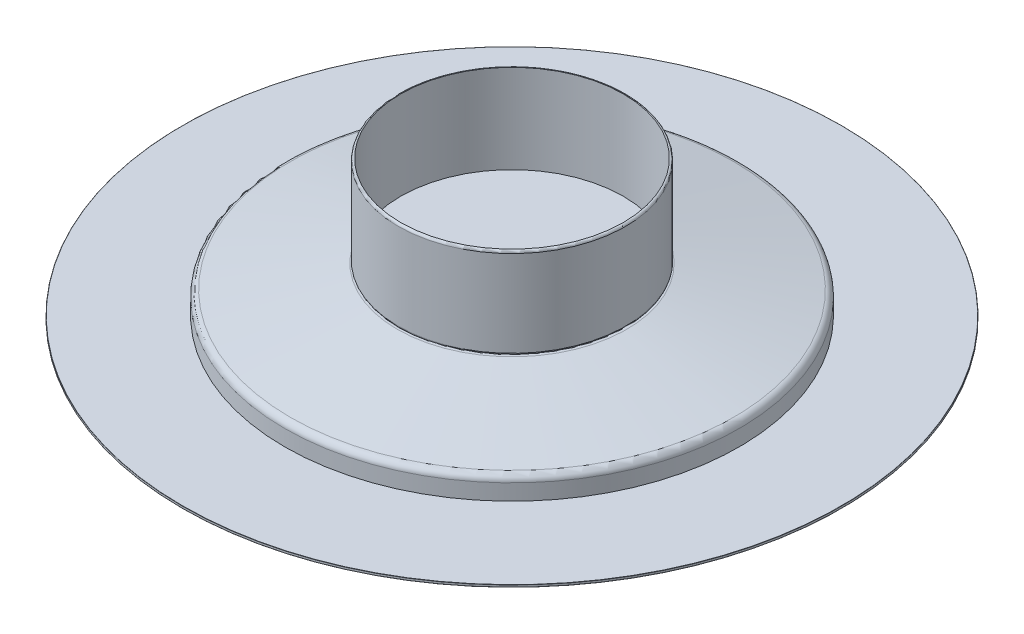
SolidWorks part; units mm, degrees
ref_plane "Alzado" through (0, 0, 0) normal (0, 0, 1) x (1, 0, 0)
ref_plane "Planta" through (0, 0, 0) normal (0, 1, 0) x (1, 0, 0)
ref_plane "Vista lateral" through (0, 0, 0) normal (1, 0, 0) x (0, 0, -1)
sketch "Croquis1" plane through (0, 0, 0) normal (0, 1, 0) x (1, 0, 0)
  circle A0 centre (0, 0) radius 145
  dimension "D1" = 290
extrude "Saliente-Extruir1" add sketch "Croquis1" along normal blind 1
fillet "Redondeo1" radius 0.1 2 edges at (0, 0, 145) (0, 1, 145)
ref_plane "Plano1" through (0, 1, 0) normal (0, 1, 0) x (1, 0, 0)
sketch "Croquis2" plane through (0, 1, 0) normal (0, 1, 0) x (1, 0, 0)
  circle A0 centre (0, 0) radius 100
  dimension "D1" = 200
extrude "Saliente-Extruir2" add sketch "Croquis2" along normal blind 10 separate body
ref_plane "Plano2" through (0, 11, 0) normal (0, 1, 0) x (1, 0, 0)
ref_plane "Plano3" through (0, 11, 0) normal (0, 1, 0) x (1, 0, 0)
sketch "Croquis4" plane through (0, 11, 0) normal (0, 1, 0) x (1, 0, 0)
  circle A1 centre (0, 0) radius 97.5
  dimension "D1" = 195
extrude "Saliente-Extruir4" add sketch "Croquis4" along normal blind 10 draft 78 separate body
ref_plane "Plano4" through (0, 21, 0) normal (0, 1, 0) x (1, 0, 0)
sketch "Croquis6" plane through (0, 21, 0) normal (0, 1, 0) x (1, 0, 0)
  circle A0 centre (0, 0) radius 50
  dimension "D1" = 100
extrude "Saliente-Extruir5" add sketch "Croquis6" along normal blind 40 separate body
fillet "Redondeo4" radius 1 1 edges at (0, 61, 50)
shell "Vaciado1" thickness 1
fillet "Redondeo8" radius 1 1 edges at (0, 21, 50)
fillet "Redondeo10" radius 3 1 edges at (0, 11, 100)
